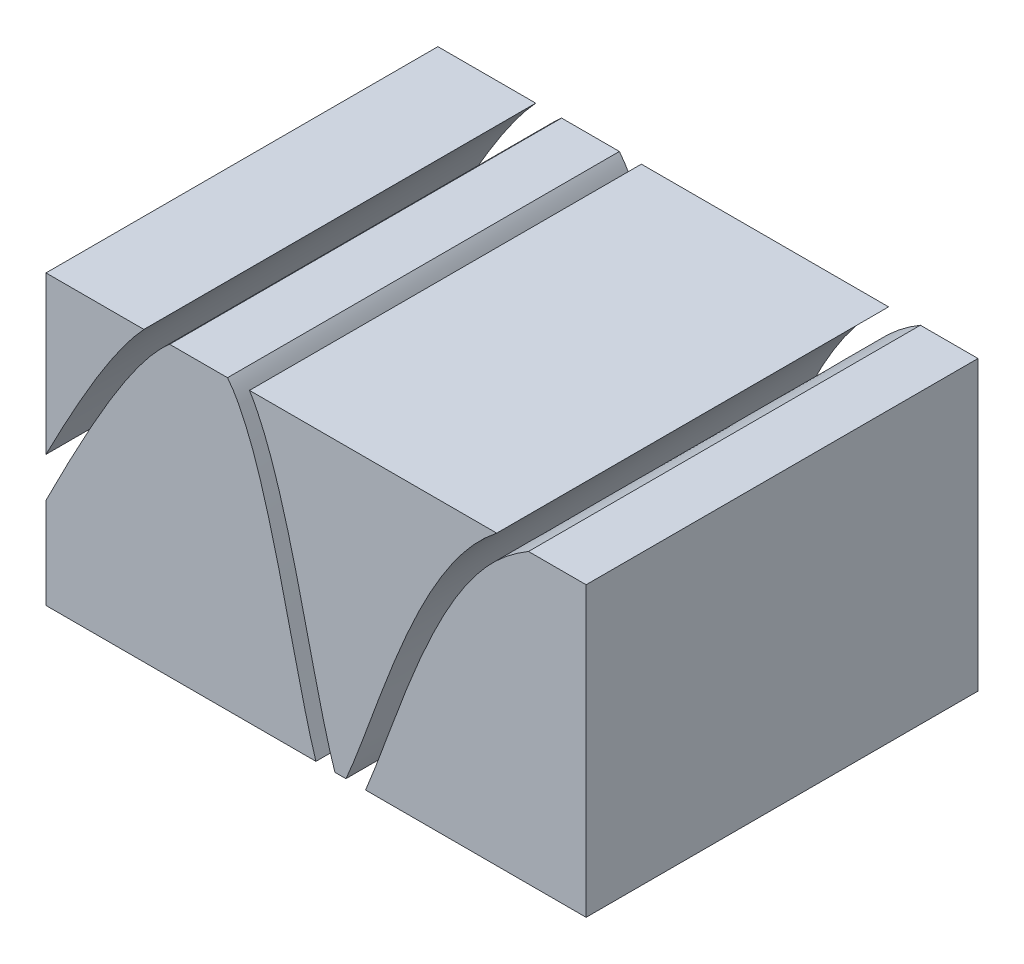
SolidWorks part; units mm, degrees
ref_plane "Front" through (0, 0, 0) normal (0, 0, 1) x (1, 0, 0)
ref_plane "Top" through (0, 0, 0) normal (0, 1, 0) x (1, 0, 0)
ref_plane "Right" through (0, 0, 0) normal (1, 0, 0) x (0, 0, -1)
sketch "Sketch4" plane through (0, 0, 0) normal (0, 0, 1) x (1, 0, 0)
  line L0 (75, -40) -> (-75, 40) construction
  line L1 (-75, 40) -> (75, 40)
  line L2 (-75, 40) -> (-75, -40)
  line L3 (-75, -40) -> (75, -40)
  line L4 (75, 40) -> (75, -40)
  dimension "D1" = 150
  dimension "D2" = 80
extrude "Extrude1" add sketch "Sketch4" along normal mid plane 108.8303
sketch "Sketch5" plane through (0, 0, 54.4152) normal (0, 0, 1) x (1, 0, 0)
  spline_without_curve S0
surface "Surface-Extrude3" sketch "Sketch5" parameters "D1"=153.8897, "D2"=37
thicken "Cut-Thicken5" surfaces to thicken 116 thickness 5 parameters "D1"=5
